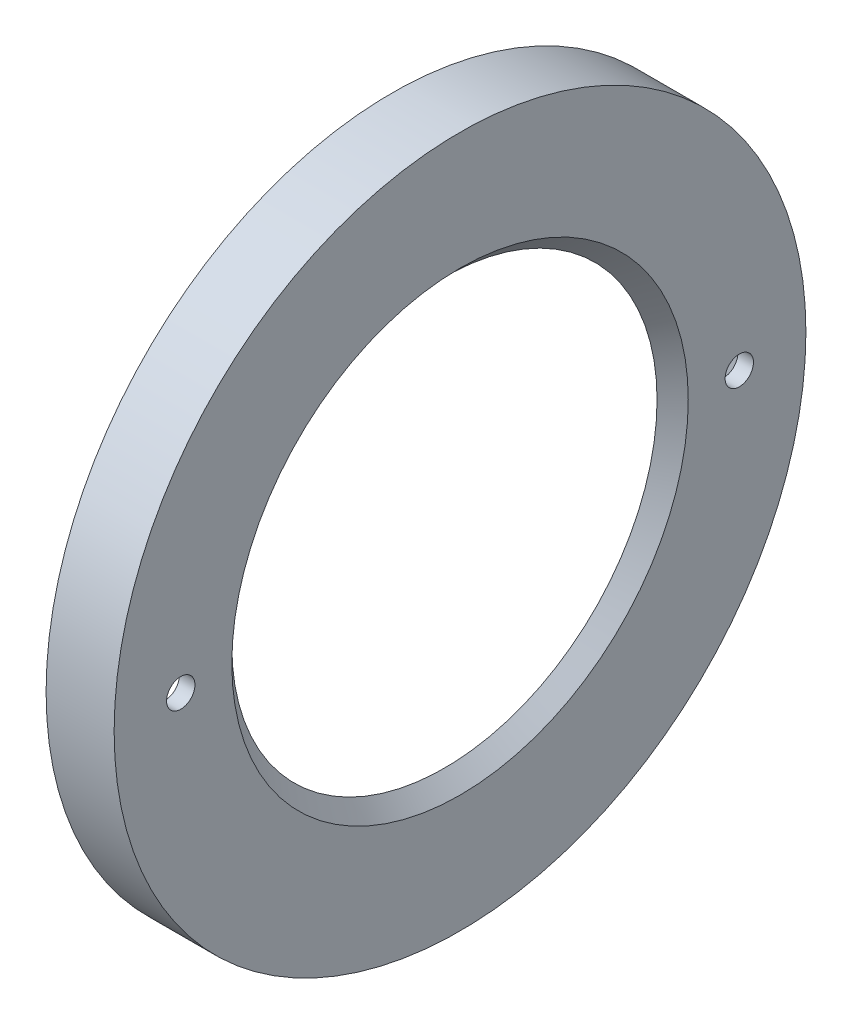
SolidWorks part; units mm, degrees
ref_plane "Front Plane" through (0, 0, 0) normal (0, 0, 1) x (1, 0, 0)
ref_plane "Top Plane" through (0, 0, 0) normal (0, 1, 0) x (1, 0, 0)
ref_plane "Right Plane" through (0, 0, 0) normal (1, 0, 0) x (0, 0, -1)
sketch "Sketch1" plane through (0, 0, 0) normal (0, 0, 1) x (1, 0, 0)
  line L0 (0, 10.6) -> (0, 12.2)
  line L1 (0, 12.2) -> (2.4, 12.2)
  line L2 (2.4, 12.2) -> (2.4, 7.5)
  line L5 (-1.0231, 0) -> (3.3899, 0) construction
  line L7 (1.85, 7.5) -> (2.4, 7.5)
  line L8 (0, 10.6) -> (1.85, 10.6)
  line L9 (1.85, 10.6) -> (1.85, 7.5)
revolve "Revolve1" add sketch "Sketch1" angle 360 about L5
sketch "Sketch2" plane through (2.4, 0, 0) normal (1, 0, 0) x (0, 0, -1)
  circle A2 centre (-9.85, 0) radius 0.5
  circle A3 centre (9.85, 0) radius 0.5
extrude "Cut-Extrude1" cut sketch "Sketch2" against normal up to next
chamfer "Chamfer1" distance 0.55 angle 45 1 edges at (2.4, 0, 7.5)
